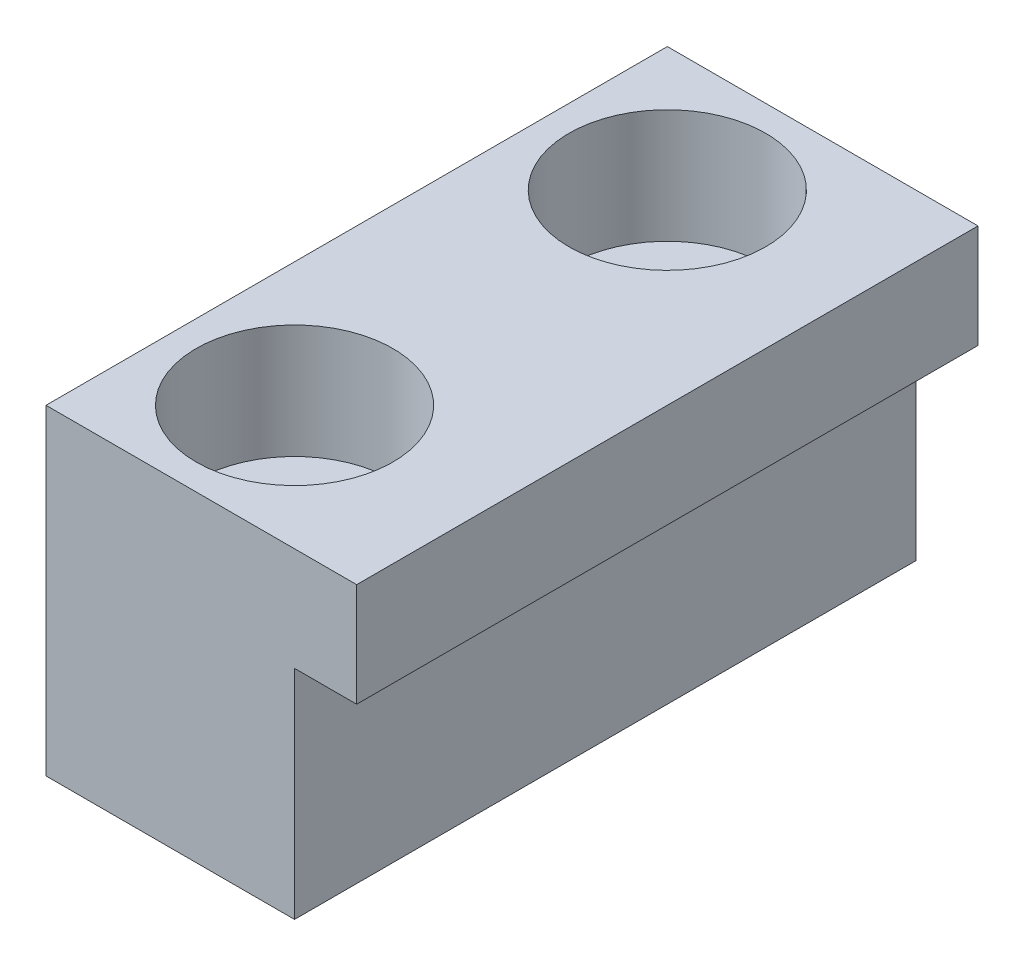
SolidWorks part; units mm, degrees
ref_plane "前视基准面" through (0, 0, 0) normal (0, 0, 1) x (1, 0, 0)
ref_plane "上视基准面" through (0, 0, 0) normal (0, 1, 0) x (1, 0, 0)
ref_plane "右视基准面" through (0, 0, 0) normal (1, 0, 0) x (0, 0, -1)
sketch "草图1" plane through (0, 0, 0) normal (0, 0, 1) x (1, 0, 0)
  line L0 (0, 0) -> (12, 0)
  line L1 (12, 0) -> (12, 10.5)
  line L2 (0, 0) -> (0, 15.5)
  line L3 (12, 10.5) -> (15, 10.5)
  line L4 (0, 15.5) -> (15, 15.5)
  line L5 (15, 10.5) -> (15, 15.5)
extrude "凸台-拉伸1" add sketch "草图1" along normal blind 30
sketch "草图2" plane through (0, 15.5, 0) normal (0, 1, 0) x (1, 0, 0)
  circle A0 centre (6, -6) radius 2.75
  circle A1 centre (6, -24) radius 2.75
extrude "切除-拉伸1" cut sketch "草图2" against normal blind 30
sketch "草图3" plane through (0, 15.5, 0) normal (0, 1, 0) x (1, 0, 0)
  circle A0 centre (6, -6) radius 4.75
  circle A1 centre (6, -24) radius 4.75
extrude "切除-拉伸2" cut sketch "草图3" against normal blind 5.5
